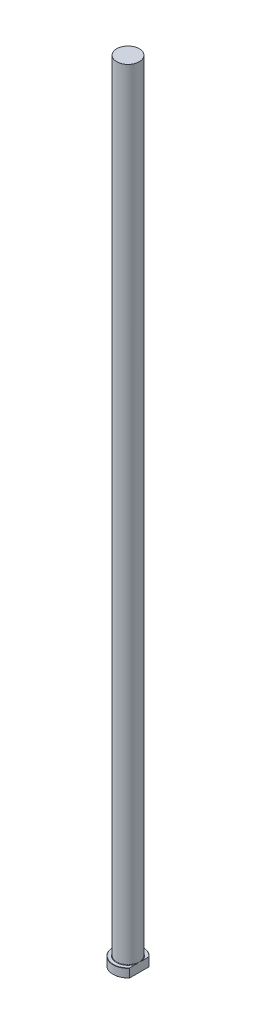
SolidWorks part; units mm, degrees
ref_plane "Front Plane" through (0, 0, 0) normal (0, 0, 1) x (1, 0, 0)
ref_plane "Top Plane" through (0, 0, 0) normal (0, 1, 0) x (1, 0, 0)
ref_plane "Right Plane" through (0, 0, 0) normal (1, 0, 0) x (0, 0, -1)
sketch "Sketch1" plane through (0, 0, 0) normal (0, 0, 1) x (1, 0, 0)
  line L0 (0, 259.9588) -> (0, -15.1925) construction
  line L1 (0, 0) -> (-12, 0)
  line L2 (-12, 0) -> (-12, 7)
  line L3 (-12, 7) -> (-9, 7)
  line L4 (-9, 7) -> (-9, 630)
  line L5 (-9, 630) -> (0, 630)
  line L6 (0, 630) -> (0, 0)
  dimension "L" = 630
  dimension "H" = 24
  dimension "T" = 7
  dimension "D" = 18
revolve "Revolve1" add sketch "Sketch1" angle 360 about L0
chamfer "Chamfer1" distance 0.2 angle 45 2 edges at (0, 7, 12) (0, 0, 12)
fillet "Fillet1" radius 0.3 1 edges at (0, 7, 9)
sketch "Sketch2" plane through (0, 0, 0) normal (0, 1, 0) x (1, 0, 0)
  line L0 (9, 7.9373) -> (9, -7.9373)
  circle A0 centre (0, 0) radius 12 construction
  arc A1 (9, -7.9373) -> (9, 7.9373) centre (0, 0) ccw
  circle A2 centre (0, 0) radius 9 construction
extrude "KEY" cut sketch "Sketch2" along normal through all
